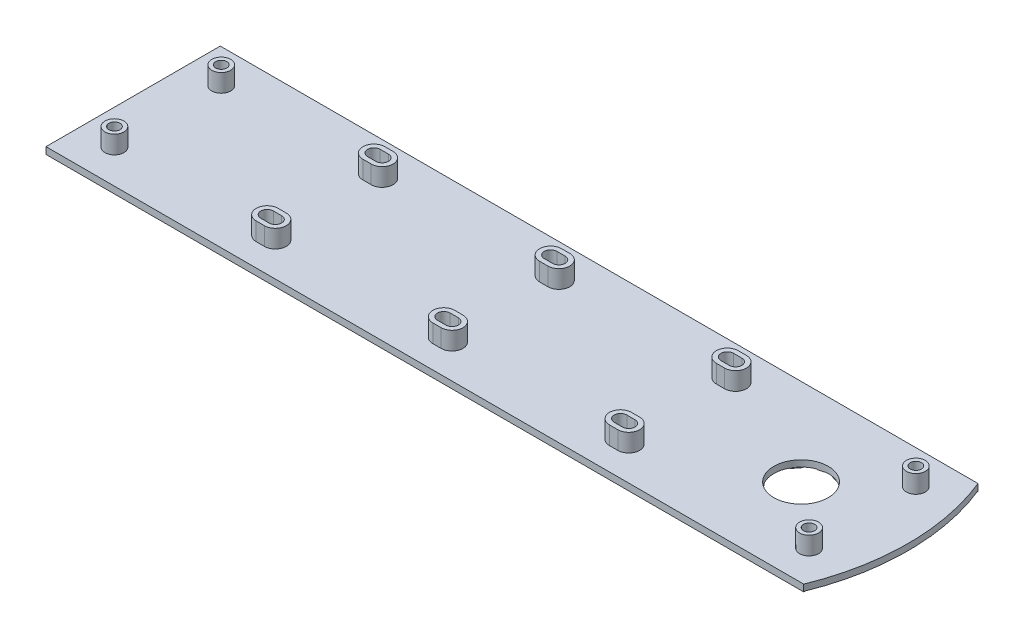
SolidWorks part; units mm, degrees
ref_plane "Front Plane" through (0, 0, 0) normal (0, 0, 1) x (1, 0, 0)
ref_plane "Top Plane" through (0, 0, 0) normal (0, 1, 0) x (1, 0, 0)
ref_plane "Right Plane" through (0, 0, 0) normal (1, 0, 0) x (0, 0, -1)
sketch "Sketch1" plane through (0, 0, 0) normal (0, 1, 0) x (1, 0, 0)
  line L1 (78.05, 17.95) -> (-78.05, 17.95)
  line L2 (78.05, 17.95) -> (78.05, -17.95)
  line L3 (78.05, -17.95) -> (-78.05, -17.95)
  line L4 (-78.05, 17.95) -> (-78.05, -17.95)
  circle A0 centre (59.55, 0) radius 5.6
  point P0 (0, 0)
  dimension "D3" = 11.2
  dimension "D4" = 18.5
  dimension "D1" = 156.1
  dimension "D2" = 35.9
extrude "Boss-Extrude1" add sketch "Sketch1" along normal blind 1.3
sketch "Sketch2" plane through (0, 1.3, 0) normal (0, 1, 0) x (1, 0, 0)
  line L0 (-78.05, 0) -> (78.05, 0) construction
  line L1 (-78.05, 17.95) -> (-78.05, -17.95) construction
  line L2 (78.05, -17.95) -> (78.05, 17.95) construction
  line L3 (-39.45, 11) -> (-37.75, 11) construction
  line L4 (-39.45, 13.25) -> (-37.75, 13.25)
  line L5 (-39.45, 8.75) -> (-37.75, 8.75)
  line L6 (-39.45, 11) -> (-37.75, 11) construction
  line L7 (-39.45, 12.3) -> (-37.75, 12.3)
  line L8 (-39.45, 9.7) -> (-37.75, 9.7)
  line L9 (78.05, 17.95) -> (-78.05, 17.95) construction
  line L10 (-3.05, 11) -> (-1.35, 11) construction
  line L11 (-3.05, 13.25) -> (-1.35, 13.25)
  line L12 (-3.05, 8.75) -> (-1.35, 8.75)
  line L13 (-3.05, 11) -> (-1.35, 11) construction
  line L14 (-3.05, 12.3) -> (-1.35, 12.3)
  line L15 (-3.05, 9.7) -> (-1.35, 9.7)
  line L16 (33.35, 11) -> (35.05, 11) construction
  line L17 (33.35, 13.25) -> (35.05, 13.25)
  line L18 (33.35, 8.75) -> (35.05, 8.75)
  line L19 (33.35, 11) -> (35.05, 11) construction
  line L20 (33.35, 12.3) -> (35.05, 12.3)
  line L21 (33.35, 9.7) -> (35.05, 9.7)
  line L22 (33.35, -11) -> (35.05, -11) construction
  line L23 (33.35, -12.3) -> (35.05, -12.3)
  line L24 (33.35, -9.7) -> (35.05, -9.7)
  line L25 (33.35, -11) -> (35.05, -11) construction
  line L26 (33.35, -13.25) -> (35.05, -13.25)
  line L27 (33.35, -8.75) -> (35.05, -8.75)
  line L28 (-3.05, -11) -> (-1.35, -11) construction
  line L29 (-3.05, -12.3) -> (-1.35, -12.3)
  line L30 (-3.05, -9.7) -> (-1.35, -9.7)
  line L31 (-3.05, -11) -> (-1.35, -11) construction
  line L32 (-3.05, -13.25) -> (-1.35, -13.25)
  line L33 (-3.05, -8.75) -> (-1.35, -8.75)
  line L34 (-39.45, -11) -> (-37.75, -11) construction
  line L35 (-39.45, -12.3) -> (-37.75, -12.3)
  line L36 (-39.45, -9.7) -> (-37.75, -9.7)
  line L37 (-39.45, -11) -> (-37.75, -11) construction
  line L38 (-39.45, -13.25) -> (-37.75, -13.25)
  line L39 (-39.45, -8.75) -> (-37.75, -8.75)
  circle A0 centre (-70.9, 11) radius 1.95
  circle A1 centre (-70.9, 11) radius 1.15
  circle A2 centre (72.2, 11) radius 1.95
  circle A3 centre (72.2, 11) radius 1.15
  arc A4 (-39.45, 13.25) -> (-39.45, 8.75) centre (-39.45, 11) ccw
  arc A5 (-37.75, 8.75) -> (-37.75, 13.25) centre (-37.75, 11) ccw
  arc A6 (-39.45, 12.3) -> (-39.45, 9.7) centre (-39.45, 11) ccw
  arc A7 (-37.75, 9.7) -> (-37.75, 12.3) centre (-37.75, 11) ccw
  arc A8 (-3.05, 13.25) -> (-3.05, 8.75) centre (-3.05, 11) ccw
  arc A9 (-1.35, 8.75) -> (-1.35, 13.25) centre (-1.35, 11) ccw
  arc A10 (-3.05, 12.3) -> (-3.05, 9.7) centre (-3.05, 11) ccw
  arc A11 (-1.35, 9.7) -> (-1.35, 12.3) centre (-1.35, 11) ccw
  arc A12 (33.35, 13.25) -> (33.35, 8.75) centre (33.35, 11) ccw
  arc A13 (35.05, 8.75) -> (35.05, 13.25) centre (35.05, 11) ccw
  arc A14 (33.35, 12.3) -> (33.35, 9.7) centre (33.35, 11) ccw
  arc A15 (35.05, 9.7) -> (35.05, 12.3) centre (35.05, 11) ccw
  circle A16 centre (72.2, -11) radius 1.15
  circle A17 centre (72.2, -11) radius 1.95
  circle A18 centre (-70.9, -11) radius 1.15
  circle A19 centre (-70.9, -11) radius 1.95
  arc A20 (33.35, -12.3) -> (33.35, -9.7) centre (33.35, -11) cw
  arc A21 (35.05, -9.7) -> (35.05, -12.3) centre (35.05, -11) cw
  arc A22 (33.35, -13.25) -> (33.35, -8.75) centre (33.35, -11) cw
  arc A23 (35.05, -8.75) -> (35.05, -13.25) centre (35.05, -11) cw
  arc A24 (-3.05, -12.3) -> (-3.05, -9.7) centre (-3.05, -11) cw
  arc A25 (-1.35, -9.7) -> (-1.35, -12.3) centre (-1.35, -11) cw
  arc A26 (-3.05, -13.25) -> (-3.05, -8.75) centre (-3.05, -11) cw
  arc A27 (-1.35, -8.75) -> (-1.35, -13.25) centre (-1.35, -11) cw
  arc A28 (-39.45, -12.3) -> (-39.45, -9.7) centre (-39.45, -11) cw
  arc A29 (-37.75, -9.7) -> (-37.75, -12.3) centre (-37.75, -11) cw
  arc A30 (-39.45, -13.25) -> (-39.45, -8.75) centre (-39.45, -11) cw
  arc A31 (-37.75, -8.75) -> (-37.75, -13.25) centre (-37.75, -11) cw
  point P12 (-38.6, 11)
  point P19 (-41.7, 11)
  point P20 (-35.5, 11)
  point P23 (-38.6, 11)
  point P28 (-40.75, 11)
  point P29 (-36.45, 11)
  point P32 (-2.2, 11)
  point P39 (-5.3, 11)
  point P40 (0.9, 11)
  point P43 (-2.2, 11)
  point P48 (-4.35, 11)
  point P49 (-0.05, 11)
  point P50 (34.2, 11)
  point P57 (31.1, 11)
  point P58 (37.3, 11)
  point P61 (34.2, 11)
  point P66 (32.05, 11)
  point P67 (36.35, 11)
  point P68 (0, 0)
  point P69 (0, 0)
  point P70 (0, 0)
  point P79 (34.2, -11)
  point P86 (34.2, -11)
  point P93 (-2.2, -11)
  point P100 (-2.2, -11)
  point P107 (-38.6, -11)
  point P114 (-38.6, -11)
  dimension "D1" = 3.9
  dimension "D2" = 2.3
  dimension "D13" = 7.15
  dimension "D16" = 5.85
  dimension "D3" = 6.2
  dimension "D4" = 4.5
  dimension "D5" = 2.6
  dimension "D6" = 4.3
  dimension "D7" = 6.95
  dimension "D8" = 6.95
  dimension "D9" = 6.95
  dimension "D10" = 6.95
  dimension "D11" = 6.95
  dimension "D12" = 32.3
  dimension "D14" = 36.4
  dimension "D15" = 36.4
  dimension "D17" = 38
extrude "Boss-Extrude2" add sketch "Sketch2" along normal blind 3.7
sketch "Sketch3" plane through (0, 0, 0) normal (0, -1, 0) x (1, 0, 0)
  line L0 (78.05, -17.95) -> (-78.05, -17.95) construction
  line L4 (-78.0063, 17.95) -> (-76.8063, 17.95)
  line L5 (-78.0063, 17.95) -> (-78.0063, -17.95)
  line L6 (-78.0063, -17.95) -> (-76.8063, -17.95)
  line L7 (-76.8063, 17.95) -> (-76.8063, -17.95)
  line L8 (-78.0063, 17.95) -> (-76.8063, -17.95) construction
  line L9 (-78.0063, -17.95) -> (-76.8063, 17.95) construction
  line L11 (-73.8063, 17.95) -> (-72.6063, 17.95)
  line L12 (-73.8063, 17.95) -> (-73.8063, -17.95)
  line L13 (-73.8063, -17.95) -> (-72.6063, -17.95)
  line L14 (-72.6063, 17.95) -> (-72.6063, -17.95)
  line L15 (-73.8063, 17.95) -> (-72.6063, -17.95) construction
  line L16 (-73.8063, -17.95) -> (-72.6063, 17.95) construction
  line L17 (-69.6063, 17.95) -> (-68.4063, 17.95)
  line L18 (-69.6063, 17.95) -> (-69.6063, -17.95)
  line L19 (-69.6063, -17.95) -> (-68.4063, -17.95)
  line L20 (-68.4063, 17.95) -> (-68.4063, -17.95)
  line L21 (-69.6063, 17.95) -> (-68.4063, -17.95) construction
  line L22 (-69.6063, -17.95) -> (-68.4063, 17.95) construction
  line L23 (-65.4063, 17.95) -> (-64.2063, 17.95)
  line L24 (-65.4063, 17.95) -> (-65.4063, -17.95)
  line L25 (-65.4063, -17.95) -> (-64.2063, -17.95)
  line L26 (-64.2063, 17.95) -> (-64.2063, -17.95)
  line L27 (-65.4063, 17.95) -> (-64.2063, -17.95) construction
  line L28 (-65.4063, -17.95) -> (-64.2063, 17.95) construction
  line L133 (7.7937, 17.95) -> (7.7937, -17.95)
  line L134 (6.5937, 17.95) -> (6.5937, -17.95)
  line L135 (6.5937, 17.95) -> (7.7937, 17.95)
  line L137 (10.7937, 17.95) -> (10.7937, -17.95)
  line L138 (9.5937, 17.95) -> (9.5937, -17.95)
  line L139 (9.5937, 17.95) -> (10.7937, 17.95)
  line L141 (13.7937, 17.95) -> (13.7937, -17.95)
  line L142 (12.5937, 17.95) -> (12.5937, -17.95)
  line L143 (12.5937, 17.95) -> (13.7937, 17.95)
  line L145 (16.7937, 17.95) -> (16.7937, -17.95)
  line L146 (15.5937, 17.95) -> (15.5937, -17.95)
  line L147 (15.5937, 17.95) -> (16.7937, 17.95)
  line L149 (19.7937, 17.95) -> (19.7937, -17.95)
  line L150 (18.5937, 17.95) -> (18.5937, -17.95)
  line L151 (18.5937, 17.95) -> (19.7937, 17.95)
  line L153 (22.7937, 17.95) -> (22.7937, -17.95)
  line L154 (21.5937, 17.95) -> (21.5937, -17.95)
  line L155 (21.5937, 17.95) -> (22.7937, 17.95)
  line L157 (25.7937, 17.95) -> (25.7937, -17.95)
  line L158 (24.5937, 17.95) -> (24.5937, -17.95)
  line L159 (24.5937, 17.95) -> (25.7937, 17.95)
  line L161 (28.7937, 17.95) -> (28.7937, -17.95)
  line L162 (27.5937, 17.95) -> (27.5937, -17.95)
  line L163 (27.5937, 17.95) -> (28.7937, 17.95)
  line L165 (31.7937, 17.95) -> (31.7937, -17.95)
  line L166 (30.5937, 17.95) -> (30.5937, -17.95)
  line L167 (30.5937, 17.95) -> (31.7937, 17.95)
  line L169 (34.7937, 17.95) -> (34.7937, -17.95)
  line L170 (33.5937, 17.95) -> (33.5937, -17.95)
  line L171 (33.5937, 17.95) -> (34.7937, 17.95)
  line L173 (37.7937, 17.95) -> (37.7937, -17.95)
  line L174 (36.5937, 17.95) -> (36.5937, -17.95)
  line L175 (36.5937, 17.95) -> (37.7937, 17.95)
  line L177 (40.7937, 17.95) -> (40.7937, -17.95)
  line L178 (39.5937, 17.95) -> (39.5937, -17.95)
  line L179 (39.5937, 17.95) -> (40.7937, 17.95)
  line L181 (43.7937, 17.95) -> (43.7937, -17.95)
  line L182 (42.5937, 17.95) -> (42.5937, -17.95)
  line L183 (42.5937, 17.95) -> (43.7937, 17.95)
  line L185 (46.7937, 17.95) -> (46.7937, -17.95)
  line L186 (45.5937, 17.95) -> (45.5937, -17.95)
  line L187 (45.5937, 17.95) -> (46.7937, 17.95)
  line L189 (49.7937, 17.95) -> (49.7937, -17.95)
  line L190 (48.5937, 17.95) -> (48.5937, -17.95)
  line L191 (48.5937, 17.95) -> (49.7937, 17.95)
  line L193 (52.7937, 17.95) -> (52.7937, -17.95)
  line L194 (51.5937, 17.95) -> (51.5937, -17.95)
  line L195 (51.5937, 17.95) -> (52.7937, 17.95)
  line L199 (54.5937, 17.95) -> (55.7937, 17.95)
  line L203 (57.5937, 17.95) -> (58.7937, 17.95)
  line L207 (60.5937, 17.95) -> (61.7937, 17.95)
  line L211 (63.5937, 17.95) -> (64.7937, 17.95)
  line L213 (67.7937, 17.95) -> (67.7937, -17.95)
  line L214 (66.5937, 17.95) -> (66.5937, -17.95)
  line L215 (66.5937, 17.95) -> (67.7937, 17.95)
  line L217 (70.7937, 17.95) -> (70.7937, -17.95)
  line L218 (69.5937, 17.95) -> (69.5937, -17.95)
  line L219 (69.5937, 17.95) -> (70.7937, 17.95)
  line L221 (73.7937, 17.95) -> (73.7937, -17.95)
  line L222 (72.5937, 17.95) -> (72.5937, -17.95)
  line L223 (72.5937, 17.95) -> (73.7937, 17.95)
  line L225 (76.7937, 17.95) -> (76.7937, -17.95)
  line L226 (75.5937, 17.95) -> (75.5937, -17.95)
  line L227 (75.5937, 17.95) -> (76.7937, 17.95)
  line L229 (-62.4063, 17.95) -> (-61.2063, 17.95)
  line L230 (-59.4063, 17.95) -> (-58.2063, 17.95)
  line L231 (-55.2063, 17.95) -> (-55.2063, -17.95)
  line L232 (-56.4063, 17.95) -> (-56.4063, -17.95)
  line L233 (-56.4063, 17.95) -> (-55.2063, 17.95)
  line L234 (-56.4063, -17.95) -> (-55.2063, -17.95)
  line L235 (-52.2063, 17.95) -> (-52.2063, -17.95)
  line L236 (-53.4063, 17.95) -> (-53.4063, -17.95)
  line L237 (-53.4063, 17.95) -> (-52.2063, 17.95)
  line L238 (-53.4063, -17.95) -> (-52.2063, -17.95)
  line L239 (-49.2063, 17.95) -> (-49.2063, -17.95)
  line L240 (-50.4063, 17.95) -> (-50.4063, -17.95)
  line L241 (-50.4063, 17.95) -> (-49.2063, 17.95)
  line L242 (-50.4063, -17.95) -> (-49.2063, -17.95)
  line L243 (-46.2063, 17.95) -> (-46.2063, -17.95)
  line L244 (-47.4063, 17.95) -> (-47.4063, -17.95)
  line L245 (-47.4063, 17.95) -> (-46.2063, 17.95)
  line L246 (-47.4063, -17.95) -> (-46.2063, -17.95)
  line L247 (-43.2063, 17.95) -> (-43.2063, -17.95)
  line L248 (-44.4063, 17.95) -> (-44.4063, -17.95)
  line L249 (-44.4063, 17.95) -> (-43.2063, 17.95)
  line L250 (-44.4063, -17.95) -> (-43.2063, -17.95)
  line L251 (-40.2063, 17.95) -> (-40.2063, -17.95)
  line L252 (-41.4063, 17.95) -> (-41.4063, -17.95)
  line L253 (-41.4063, 17.95) -> (-40.2063, 17.95)
  line L254 (-41.4063, -17.95) -> (-40.2063, -17.95)
  line L255 (-37.2063, 17.95) -> (-37.2063, -17.95)
  line L256 (-38.4063, 17.95) -> (-38.4063, -17.95)
  line L257 (-38.4063, 17.95) -> (-37.2063, 17.95)
  line L258 (-38.4063, -17.95) -> (-37.2063, -17.95)
  line L259 (-34.2063, 17.95) -> (-34.2063, -17.95)
  line L260 (-35.4063, 17.95) -> (-35.4063, -17.95)
  line L261 (-35.4063, 17.95) -> (-34.2063, 17.95)
  line L262 (-35.4063, -17.95) -> (-34.2063, -17.95)
  line L263 (-31.2063, 17.95) -> (-31.2063, -17.95)
  line L264 (-32.4063, 17.95) -> (-32.4063, -17.95)
  line L265 (-32.4063, 17.95) -> (-31.2063, 17.95)
  line L266 (-32.4063, -17.95) -> (-31.2063, -17.95)
  line L267 (-28.2063, 17.95) -> (-28.2063, -17.95)
  line L268 (-29.4063, 17.95) -> (-29.4063, -17.95)
  line L269 (-29.4063, 17.95) -> (-28.2063, 17.95)
  line L270 (-29.4063, -17.95) -> (-28.2063, -17.95)
  line L271 (-26.4063, 17.95) -> (-26.4063, -17.95)
  line L272 (-26.4063, -17.95) -> (-25.2063, -17.95)
  line L273 (-23.4063, -17.95) -> (-22.2063, -17.95)
  line L274 (-61.2063, 17.95) -> (-61.2063, -17.95)
  line L275 (-62.4063, 17.95) -> (-62.4063, -17.95)
  line L276 (-62.4063, -17.95) -> (-61.2063, -17.95)
  line L277 (-58.2063, 17.95) -> (-58.2063, -17.95)
  line L278 (-59.4063, 17.95) -> (-59.4063, -17.95)
  line L279 (-59.4063, -17.95) -> (-58.2063, -17.95)
  line L280 (-25.2063, 17.95) -> (-25.2063, -17.95)
  line L281 (-26.4063, 17.95) -> (-25.2063, 17.95)
  line L282 (-22.2063, 17.95) -> (-22.2063, -17.95)
  line L283 (-23.4063, 17.95) -> (-23.4063, -17.95)
  line L284 (-23.4063, 17.95) -> (-22.2063, 17.95)
  line L285 (-78.0063, -17.95) -> (-76.8063, -17.95)
  line L286 (-64.1674, 17.9822) -> (3.5326, 17.9822)
  line L287 (-64.1674, 17.9822) -> (-64.1674, -17.95)
  line L288 (-64.1674, -17.95) -> (78.05, -17.95)
  line L290 (6.5937, -17.95) -> (7.7937, -17.95)
  line L291 (55.7937, 17.95) -> (55.7937, 4.1533)
  line L292 (-19.2063, 17.95) -> (-19.2063, -17.95)
  line L293 (-20.4063, 17.95) -> (-20.4063, -17.95)
  line L294 (-20.4063, 17.95) -> (-19.2063, 17.95)
  line L295 (-20.4063, -17.95) -> (-19.2063, -17.95)
  line L296 (-16.2063, 17.95) -> (-16.2063, -17.95)
  line L297 (-17.4063, 17.95) -> (-17.4063, -17.95)
  line L298 (-17.4063, 17.95) -> (-16.2063, 17.95)
  line L299 (-17.4063, -17.95) -> (-16.2063, -17.95)
  line L300 (-13.2063, 17.95) -> (-13.2063, -17.95)
  line L301 (-14.4063, 17.95) -> (-14.4063, -17.95)
  line L302 (-14.4063, 17.95) -> (-13.2063, 17.95)
  line L303 (-14.4063, -17.95) -> (-13.2063, -17.95)
  line L304 (-10.2063, 17.95) -> (-10.2063, -17.95)
  line L305 (-11.4063, 17.95) -> (-11.4063, -17.95)
  line L306 (-11.4063, 17.95) -> (-10.2063, 17.95)
  line L307 (-11.4063, -17.95) -> (-10.2063, -17.95)
  line L308 (-7.2063, 17.95) -> (-7.2063, -17.95)
  line L309 (-8.4063, 17.95) -> (-8.4063, -17.95)
  line L310 (-8.4063, 17.95) -> (-7.2063, 17.95)
  line L311 (-8.4063, -17.95) -> (-7.2063, -17.95)
  line L312 (-4.2063, 17.95) -> (-4.2063, -17.95)
  line L313 (-5.4063, 17.95) -> (-5.4063, -17.95)
  line L314 (-5.4063, 17.95) -> (-4.2063, 17.95)
  line L315 (-5.4063, -17.95) -> (-4.2063, -17.95)
  line L316 (-1.2063, 17.95) -> (-1.2063, -17.95)
  line L317 (-2.4063, 17.95) -> (-2.4063, -17.95)
  line L318 (-2.4063, 17.95) -> (-1.2063, 17.95)
  line L319 (-2.4063, -17.95) -> (-1.2063, -17.95)
  line L320 (1.7937, 17.95) -> (1.7937, -17.95)
  line L321 (0.5937, 17.95) -> (0.5937, -17.95)
  line L322 (0.5937, 17.95) -> (1.7937, 17.95)
  line L323 (0.5937, -17.95) -> (1.7937, -17.95)
  line L324 (4.7937, 17.95) -> (4.7937, -17.95)
  line L325 (3.5937, 17.95) -> (3.5937, -17.95)
  line L326 (3.5937, 17.95) -> (4.7937, 17.95)
  line L327 (3.5937, -17.95) -> (4.7937, -17.95)
  line L328 (55.7937, 17.95) -> (55.7937, -17.95)
  line L329 (54.5937, 17.95) -> (54.5937, -17.95)
  line L330 (57.5937, 17.95) -> (57.5937, -17.95)
  line L331 (58.7937, 17.95) -> (58.7937, -17.95)
  line L332 (60.5937, 17.95) -> (60.5937, -17.95)
  line L333 (61.7937, 17.95) -> (61.7937, -17.95)
  line L334 (63.5937, 17.95) -> (63.5937, -17.95)
  line L335 (64.7937, 17.95) -> (64.7937, -17.95)
  line L336 (54.5937, 17.95) -> (54.5937, 2.6067)
  line L337 (54.5937, 2.6067) -> (55.7937, 4.1533)
  line L338 (54.5937, -2.6067) -> (54.5937, -17.95)
  line L339 (55.7937, -17.95) -> (55.7937, -4.1533)
  line L340 (55.7937, -4.1533) -> (54.5937, -2.6067)
  line L341 (57.5937, 17.95) -> (57.5937, 5.2472)
  line L342 (57.5937, 5.2472) -> (58.7937, 5.5487)
  line L343 (58.7937, 5.5487) -> (58.7937, 17.95)
  line L344 (60.5937, 17.95) -> (60.5937, 5.5019)
  line L345 (60.5937, 5.5019) -> (61.7937, 5.1309)
  line L346 (61.7937, 5.1309) -> (61.7937, 17.95)
  line L347 (63.5937, 17.95) -> (63.5937, 3.8741)
  line L348 (63.5937, 3.8741) -> (64.7937, 1.9656)
  line L349 (64.7937, 1.9656) -> (64.7937, 17.95)
  line L350 (57.5937, -5.2472) -> (57.5937, -17.95)
  line L351 (58.7937, -17.95) -> (58.7937, -5.5487)
  line L352 (58.7937, -5.5487) -> (57.5937, -5.2472)
  line L353 (60.5937, -17.95) -> (60.5937, -5.5019)
  line L354 (60.5937, -5.5019) -> (61.7937, -5.1309)
  line L355 (61.7937, -5.1309) -> (61.7937, -17.95)
  line L356 (64.7937, -1.9656) -> (64.7937, -17.95)
  line L357 (63.5937, -17.95) -> (63.5937, -3.8741)
  line L358 (63.5937, -3.8741) -> (64.7937, -1.9656)
  line L359 (9.5937, -17.95) -> (10.7937, -17.95)
  line L360 (12.5937, -17.95) -> (13.7937, -17.95)
  line L361 (15.5937, -17.95) -> (16.7937, -17.95)
  line L362 (18.5937, -17.95) -> (19.7937, -17.95)
  line L363 (21.5937, -17.95) -> (22.7937, -17.95)
  line L364 (75.5937, -17.95) -> (76.7937, -17.95)
  line L365 (72.5937, -17.95) -> (73.7937, -17.95)
  line L366 (69.5937, -17.95) -> (70.7937, -17.95)
  line L367 (66.5937, -17.95) -> (67.7937, -17.95)
  line L368 (63.5937, -17.95) -> (64.7937, -17.95)
  line L369 (60.5937, -17.95) -> (61.7937, -17.95)
  line L370 (57.5937, -17.95) -> (58.7937, -17.95)
  line L371 (54.5937, -17.95) -> (55.7937, -17.95)
  line L372 (51.5937, -17.95) -> (52.7937, -17.95)
  line L373 (48.5937, -17.95) -> (49.7937, -17.95)
  line L374 (45.5937, -17.95) -> (46.7937, -17.95)
  line L375 (42.5937, -17.95) -> (43.7937, -17.95)
  line L376 (39.5937, -17.95) -> (40.7937, -17.95)
  line L377 (36.5937, -17.95) -> (37.7937, -17.95)
  line L378 (33.5937, -17.95) -> (34.7937, -17.95)
  line L379 (30.5937, -17.95) -> (31.7937, -17.95)
  line L380 (27.5937, -17.95) -> (28.7937, -17.95)
  line L381 (24.5937, -17.95) -> (25.7937, -17.95)
  line L382 (21.5937, -17.95) -> (22.7937, -17.95)
  line L383 (18.5937, -17.95) -> (19.7937, -17.95)
  line L384 (15.5937, -17.95) -> (16.7937, -17.95)
  line L385 (12.5937, -17.95) -> (13.7937, -17.95)
  line L386 (9.5937, -17.95) -> (10.7937, -17.95)
  line L387 (6.5937, -17.95) -> (7.7937, -17.95)
  line L388 (24.5937, -17.95) -> (25.7937, -17.95)
  line L389 (27.5937, -17.95) -> (28.7937, -17.95)
  line L390 (30.5937, -17.95) -> (31.7937, -17.95)
  line L391 (33.5937, -17.95) -> (34.7937, -17.95)
  line L392 (36.5937, -17.95) -> (37.7937, -17.95)
  line L393 (39.5937, -17.95) -> (40.7937, -17.95)
  line L394 (42.5937, -17.95) -> (43.7937, -17.95)
  line L395 (45.5937, -17.95) -> (46.7937, -17.95)
  line L396 (48.5937, -17.95) -> (49.7937, -17.95)
  line L397 (51.5937, -17.95) -> (52.7937, -17.95)
  line L398 (54.5937, -17.95) -> (55.7937, -17.95)
  line L399 (57.5937, -17.95) -> (58.7937, -17.95)
  line L400 (60.5937, -17.95) -> (61.7937, -17.95)
  line L401 (63.5937, -17.95) -> (64.7937, -17.95)
  line L402 (66.5937, -17.95) -> (67.7937, -17.95)
  line L403 (69.5937, -17.95) -> (70.7937, -17.95)
  line L404 (72.5937, -17.95) -> (73.7937, -17.95)
  line L405 (75.5937, -17.95) -> (76.7937, -17.95)
  circle A0 centre (59.55, 0) radius 5.6 construction
  spline S0 degree 1 poles (78.05, 17.95) (78.05, -17.95) knots 0 0 1 1
  point P0 (-77.4063, 0)
  point P7 (-73.2063, 0)
  point P12 (-69.0063, 0)
  point P17 (-64.8063, 0)
  dimension "D1" = 1.2
  dimension "D2" = 1.2
  dimension "D3" = 1.2
  dimension "D5" = 3
  dimension "D6" = 3
  dimension "D7" = 3
  dimension "D8" = 48
extrude "Boss-Extrude3" add sketch "Sketch3" along normal blind 0.1 contours L138 L137 M11 M9 | L142 L141 M11 M9 | L150 L149 M11 M9 | L158 L157 M11 M9 | L166 L165 M11 M9 | L170 L169 M11 M9 | L182 L181 M11 M9 | L288 L351 L350 M12 | L214 L213 M11 M9 | L218 L217 M11 M9 | L222 L221 M11 M9 | L226 L225 M11 M9 | L349 L347 M12 M11 | L346 L344 M12 M11 | L14 L12 M11 M9 | L20 L18 M11 M9 | L26 L24 M11 M9 | L7 L5 M11 M9 | L133 L290 L134 L135 | L146 L361 L145 L147 | L154 L363 L153 L155 | L162 L389 L161 L163 | L174 L392 L173 L175 | L178 L393 L177 L179 | L186 L395 L185 L187 | L190 L396 L189 L191 | L194 L397 L193 L195 | L338 L398 L339 L340 | L353 L354 L355 L400 | L357 L358 L356 L401 | L343 L203 L341 L342 | L291 L337 L336 L199
sketch "Sketch4" plane through (0, 0, 0) normal (0, -1, 0) x (1, 0, 0)
  line L0 (-76.8063, 16.65) -> (78.05, 16.65)
  line L1 (-76.8063, 17.95) -> (-76.8063, -17.95) construction
  line L2 (78.05, 17.95) -> (78.05, -17.95) construction
  line L3 (-64.2063, 17.95) -> (6.5937, 17.95) construction
  line L4 (-76.8063, -16.65) -> (78.05, -16.65)
  line L5 (-76.8063, 17.95) -> (-76.8063, -17.95) construction
  line L6 (6.5937, -17.95) -> (-64.2063, -17.95) construction
  line L7 (-76.8063, 16.65) -> (-76.8063, 17.95)
  line L8 (-76.8063, 17.95) -> (78.05, 17.95)
  line L9 (78.05, 17.95) -> (78.05, 16.65)
  line L10 (-76.8063, -16.65) -> (-76.8063, -17.95)
  line L11 (-76.8063, -17.95) -> (78.05, -17.95)
  line L12 (78.05, -17.95) -> (78.05, -16.65)
  dimension "D1" = 1.3
  dimension "D2" = 1.3
extrude "Boss-Extrude4" add sketch "Sketch4" along normal blind 0.1
sketch "Sketch5" plane through (0, 0, 0) normal (0, -1, 0) x (1, 0, 0)
  line L0 (-64.2063, 16.65) -> (6.5937, 16.65) construction
  line L1 (-61.0063, 12.15) -> (-2.3063, 12.15)
  line L2 (-61.0063, 12.15) -> (-61.0063, -12.15)
  line L3 (-61.0063, -12.15) -> (-2.3063, -12.15)
  line L4 (-2.3063, 12.15) -> (-2.3063, -12.15)
  line L5 (-61.0063, 12.15) -> (-2.3063, -12.15) construction
  line L6 (-61.0063, -12.15) -> (-2.3063, 12.15) construction
  line L7 (6.5937, -16.65) -> (-64.2063, -16.65) construction
  line L8 (-64.2063, 16.65) -> (-64.2063, -16.65) construction
  point P0 (-31.6563, 0)
  dimension "D1" = 4.5
  dimension "D2" = 4.5
  dimension "D3" = 58.7
  dimension "D4" = 3.2
extrude "Cut-Extrude1" cut sketch "Sketch5" against normal blind 0.1
sketch "Sketch7" plane through (0, 1.3, 0) normal (0, 1, 0) x (1, 0, 0)
  line L0 (78.05, 17.95) -> (78.05, -17.95)
  arc A0 (78.05, 17.95) -> (78.05, -17.95) centre (33.8235, 0) cw
extrude "Boss-Extrude6" add sketch "Sketch7" against normal blind 1.3
